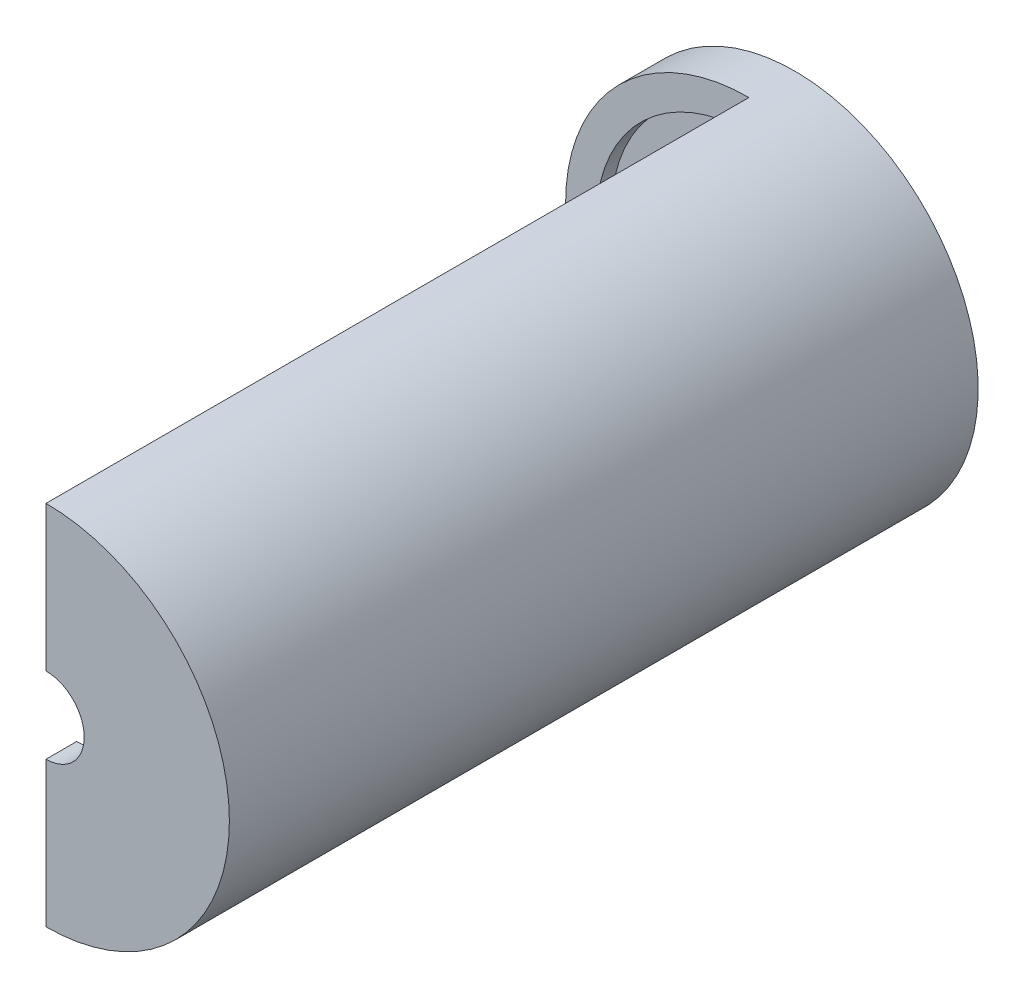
SolidWorks part; units mm, degrees
ref_plane "Plan de face" through (0, 0, 0) normal (0, 0, 1) x (1, 0, 0)
ref_plane "Plan de dessus" through (0, 0, 0) normal (0, 1, 0) x (1, 0, 0)
ref_plane "Plan de droite" through (0, 0, 0) normal (1, 0, 0) x (0, 0, -1)
sketch "Esquisse1" plane through (0, 0, 0) normal (0, 0, 1) x (1, 0, 0)
  circle A0 centre (0, 0) radius 10
extrude "Extru.-Mince1" add sketch "Esquisse1" along normal blind 45 thin
sketch "Esquisse2" plane through (0, 0, 0) normal (0, 0, -1) x (-1, 0, 0)
  circle A0 centre (0, 0) radius 12
extrude "Boss.-Extru.1" add sketch "Esquisse2" along normal blind 2
sketch "Esquisse3" plane through (0, 0, 45) normal (0, 0, 1) x (1, 0, 0)
  circle A0 centre (0, 0) radius 12
  circle A1 centre (0, 0) radius 2.5
extrude "Boss.-Extru.2" add sketch "Esquisse3" along normal blind 2
sketch "Esquisse4" plane through (0, 0, 0) normal (1, 0, 0) x (0, 0, -1)
  line L0 (2, -12) -> (2, 12) construction
  line L1 (-53.3177, 17.8981) -> (-1, 17.8981)
  line L2 (-53.3177, 17.8981) -> (-53.3177, -21.4384)
  line L3 (-53.3177, -21.4384) -> (-1, -21.4384)
  line L4 (-1, 17.8981) -> (-1, -21.4384)
  dimension "D1" = 3
extrude "Enlèv. mat.-Extru.1" cut sketch "Esquisse4" against normal through all
